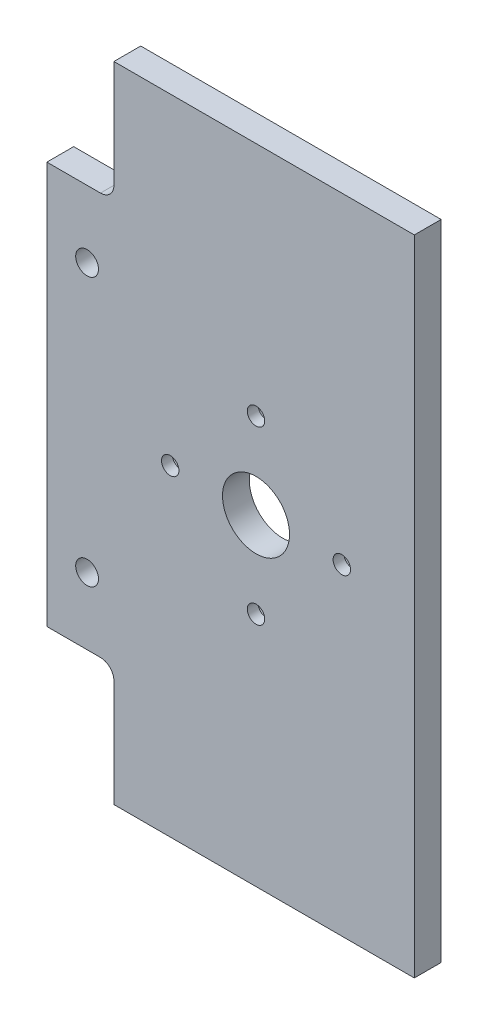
SolidWorks part; units mm, degrees
ref_plane "Plan1" through (0, 0, 0) normal (0, 0, 1) x (1, 0, 0)
ref_plane "Plan2" through (0, 0, 0) normal (0, 1, 0) x (1, 0, 0)
ref_plane "Plan3" through (0, 0, 0) normal (1, 0, 0) x (0, 0, -1)
sketch "Esquisse1" plane through (0, 0, 0) normal (0, 0, 1) x (1, 0, 0)
  line L0 (-78, 0) -> (81.5842, 0) construction
  line L1 (-53, 120) -> (59.0364, 120)
  line L2 (-78, 75) -> (-78, -75)
  line L3 (-53, -120) -> (59.0364, -120)
  line L5 (-53, -120) -> (-53, -80)
  line L6 (-78, -75) -> (-58, -75)
  line L9 (59.0364, 120) -> (59.0364, -120)
  line L12 (-78, 75) -> (-58, 75)
  line L13 (-53, 120) -> (-53, 80)
  circle A0 centre (0, 0) radius 12.5
  circle A6 centre (-63, 50) radius 4
  circle A7 centre (-63, -50) radius 4
  arc A9 (-53, 80) -> (-58, 75) centre (-58, 80) cw
  arc A11 (-53, -80) -> (-58, -75) centre (-58, -80) ccw
  dimension "D5" = 25
  dimension "D8" = 25
  dimension "D10" = 45
  dimension "D15" = 5
  dimension "D2" = 240
  dimension "D3" = 78
  dimension "D9" = 100
  dimension "D20" = 15
extrude "Base-Extrusion" add sketch "Esquisse1" along normal blind 10
sketch "Esquisse2" plane through (0, 0, 10) normal (0, 0, 1) x (1, 0, 0)
  line L0 (0, 0) -> (-55.4527, 0) construction
  line L1 (0, 0) -> (-90, 0) construction
  circle A0 centre (-32, 0) radius 3.25
  dimension "D1" = 32
  dimension "D2" = 6.5
extrude "Enlèv. mat.-Extru.1" cut sketch "Esquisse2" against normal through all
sketch "Esquisse3" plane through (0, 0, 0) normal (0, 0, -1) x (-1, 0, 0)
  circle A0 centre (32, 0) radius 6.5
  circle A1 centre (32, 0) radius 3.25 construction
  dimension "D1" = 13
extrude "Enlèv. mat.-Extru.2" cut sketch "Esquisse3" against normal blind 6
pattern_circular "Répétition circulaire1" count 4 every 90 about axis through (0, 0, 0) along (0, 0, 1) of "Enlèv. mat.-Extru.1", "Enlèv. mat.-Extru.2"
sketch "Esquisse4" plane through (0, 0, 10) normal (0, 0, 1) x (1, 0, 0)
  circle A4 centre (-63, 50) radius 4.25
  circle A5 centre (-63, -50) radius 4.25
  circle A6 centre (-63, 50) radius 4 construction
  circle A7 centre (-63, -50) radius 4 construction
  circle A14 centre (0, 0) radius 10
  circle A15 centre (0, 0) radius 12.5 construction
  dimension "D3" = 20
extrude "Enlèv. mat.-Extru.3" cut sketch "Esquisse4" against normal through all
